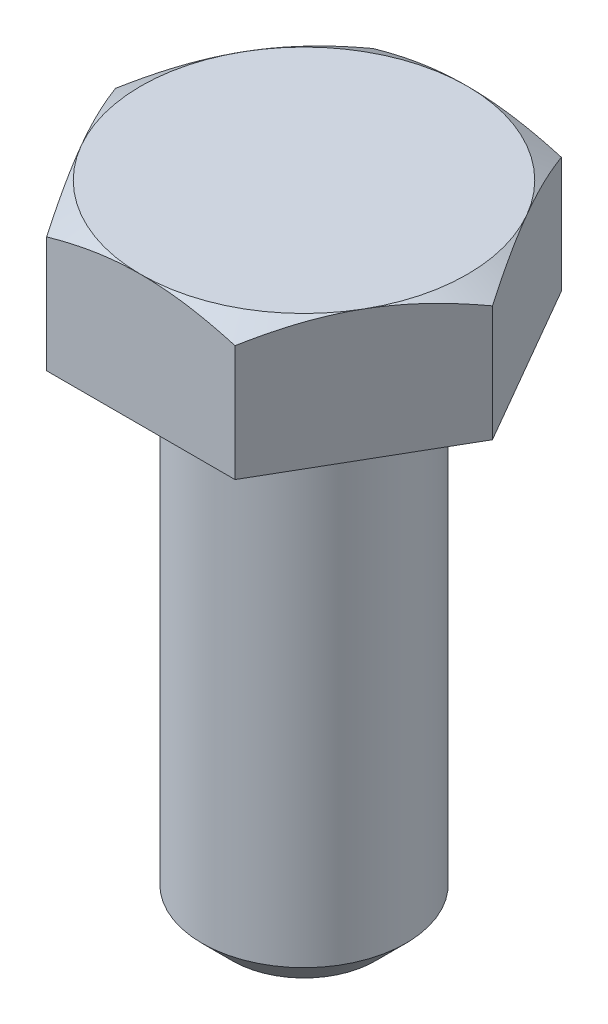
SolidWorks part; units mm, degrees
extrude "Base-Extrusion" add sketch "Esquisse2" against normal blind 25
sketch "Esquisse2" plane through (0, 0, 0) normal (0, 1, 0) x (1, 0, 0)
  circle A0 centre (0, 0) radius 5
  dimension "Diamètre nominal" = 10
chamfer "Chanfrein1" distance 1.4521 angle 45
ref_plane "Plan1" through (0, 0, 0) normal (0, 0, 1) x (1, 0, 0)
ref_plane "Plan2" through (0, 0, 0) normal (0, 1, 0) x (1, 0, 0)
ref_plane "Plan3" through (0, 0, 0) normal (1, 0, 0) x (0, 0, -1)
sketch "Esquisse5" plane through (0, 0, 0) normal (0, 0, 1) x (1, 0, 0)
  line L0 (-8, 0) -> (8, 0) construction
  line L1 (0, 0) -> (11.3137, 0)
  line L2 (0, 0) -> (0, 6.4)
  line L3 (0, 6.4) -> (8, 6.4)
  line L5 (11.3137, 0) -> (11.3137, 4.4868)
  line L6 (8, 6.4) -> (11.3137, 4.4868)
  line L7 (0, 6.4) -> (0, -25) construction
  line L8 (0, -23.5) -> (0, 0) construction
  line L9 (-3.5, -25) -> (3.5, -25) construction
revolve "Boss.-Révol.1" add sketch "Esquisse5" angle 360 about L7
sketch "Esquisse6" plane through (0, 0, 0) normal (0, -1, 0) x (1, 0, 0)
  line L0 (9.2376, 0) -> (-8, 0) construction
  line L1 (0, 0) -> (5.6569, -9.798) construction
  line L2 (0, 0) -> (9.798, -5.6569) construction
  line L3 (0, 0) -> (0, -8) construction
  line L4 (-4.6188, -8) -> (4.6188, -8)
  line L5 (4.6188, -8) -> (9.2376, 0)
  line L6 (-4.6188, 8) -> (4.6188, 8)
  line L7 (4.6188, 8) -> (9.2376, 0)
  line L8 (-4.6188, -8) -> (-9.2376, 0)
  line L9 (-4.6188, 8) -> (-9.2376, 0)
  circle A0 centre (0, 0) radius 11.3137 construction
  circle A3 centre (0, 0) radius 8 construction
  point P17 (0, 8)
  dimension "D1" = 30
  dimension "D2" = 30
extrude "Enlèv. mat.-Extru.1" cut sketch "Esquisse6" against normal blind 6.4 flip side to cut
sketch "Esquisse3" plane through (0, -25, 0) normal (0, -1, 0) x (1, 0, 0)
  circle A0 centre (0, 0) radius 5
  circle A1 centre (0, 0) radius 5 construction
equation "\"D4@Esquisse5\" = \"Cote sur plats@Esquisse5\"/2"
equation "\"D1@Esquisse5\" =(\"D4@Esquisse5\"*sqr(2)*2)/2"
